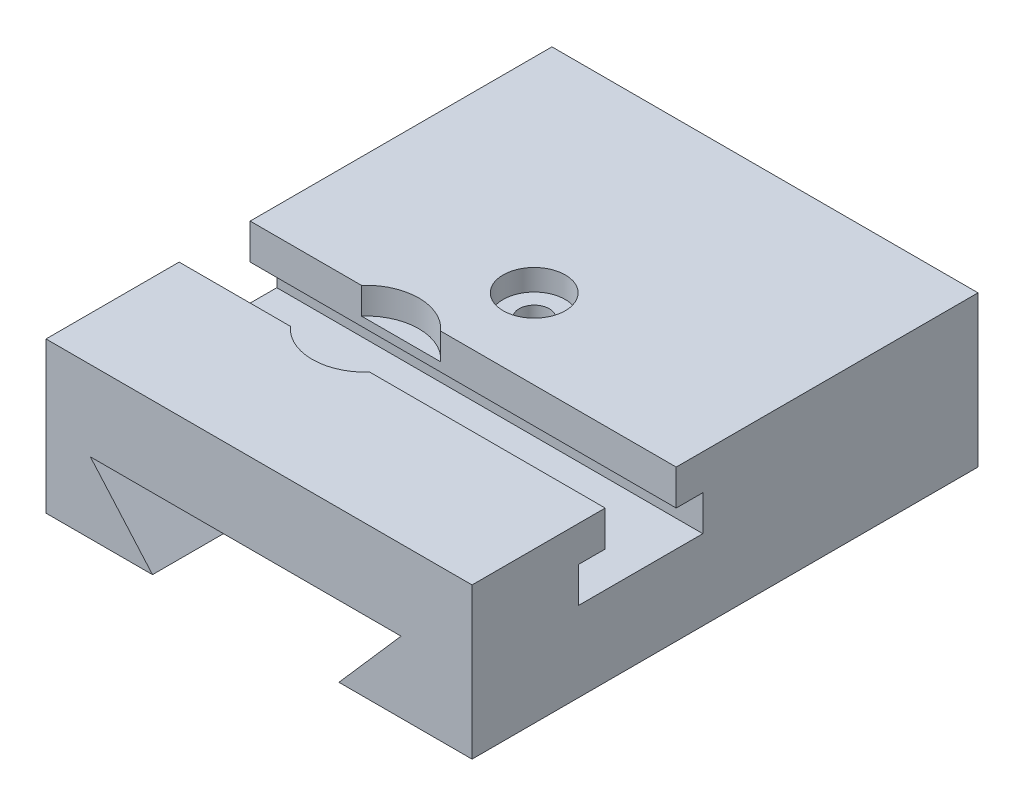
SolidWorks part; units mm, degrees
ref_plane "Piano frontale" through (0, 0, 0) normal (0, 0, 1) x (1, 0, 0)
ref_plane "Piano superiore" through (0, 0, 0) normal (0, 1, 0) x (1, 0, 0)
ref_plane "Piano destro" through (0, 0, 0) normal (1, 0, 0) x (0, 0, -1)
sketch "Schizzo1" plane through (0, 0, 0) normal (0, 1, 0) x (1, 0, 0)
  line L1 (-24, 28.5) -> (24, 28.5)
  line L2 (-24, 28.5) -> (-24, -28.5)
  line L3 (-24, -28.5) -> (24, -28.5)
  line L4 (24, 28.5) -> (24, -28.5)
  line L5 (-24, 28.5) -> (24, -28.5) construction
  line L6 (-24, -28.5) -> (24, 28.5) construction
  point P0 (0, 0)
  dimension "D1" = 48
  dimension "D2" = 57
extrude "Estrusione-Estrusione1" add sketch "Schizzo1" along normal blind 17
sketch "Schizzo2" plane through (24, 0, 0) normal (1, 0, 0) x (0, 0, -1)
  line L0 (-13.5, 17) -> (-13.5, 13)
  line L1 (-28.5, 17) -> (28.5, 17) construction
  line L2 (-13.5, 13) -> (-16.5, 13)
  line L3 (-16.5, 13) -> (-16.5, 9)
  line L4 (-16.5, 9) -> (-2.5, 9)
  line L5 (-2.5, 9) -> (-2.5, 13)
  line L6 (-2.5, 13) -> (-5.5, 13)
  line L7 (-5.5, 13) -> (-5.5, 17)
  line L8 (-5.5, 17) -> (-13.5, 17)
  dimension "D1" = 4
  dimension "D2" = 4
  dimension "D3" = 14
  dimension "D4" = 15
  dimension "D5" = 3
extrude "Taglio-Estrusione1" cut sketch "Schizzo2" against normal up to next
sketch "Schizzo4" plane through (0, 17, 0) normal (0, 1, 0) x (1, 0, 0)
  line L0 (-24, 28.5) -> (-24, -5.5) construction
  line L1 (-24, -28.5) -> (24, -28.5) construction
  circle A0 centre (-7, -9.5) radius 6
  dimension "D1" = 12
  dimension "D2" = 17
  dimension "D3" = 19
extrude "Taglio-Estrusione3" cut sketch "Schizzo4" against normal blind 3
sketch "Schizzo3" plane through (0, 0, 28.5) normal (0, 0, 1) x (1, 0, 0)
  line L0 (0, 22.4056) -> (0, -6.8626) construction
  line L1 (-7, 0) -> (-7, 3)
  line L2 (-24, 0) -> (24, 0) construction
  line L3 (-7, 3) -> (-13, 3)
  line L4 (-13, 3) -> (-13, 1.5)
  line L5 (-13, 1.5) -> (-9, 1.5)
  line L6 (-9, 1.5) -> (-9, 0)
  line L7 (-9, 0) -> (-7, 0)
  line L8 (9, 0) -> (7, 0)
  line L9 (9, 1.5) -> (9, 0)
  line L10 (13, 1.5) -> (9, 1.5)
  line L11 (13, 3) -> (13, 1.5)
  line L12 (7, 3) -> (13, 3)
  line L13 (7, 0) -> (7, 3)
  dimension "D1" = 1.5
  dimension "D2" = 1.5
  dimension "D3" = 6
  dimension "D4" = 2
  dimension "D5" = 15
extrude "Taglio-Estrusione2" [suppressed] cut sketch "Schizzo3" against normal up to next
sketch "Schizzo5" plane through (0, 0, 28.5) normal (0, 0, 1) x (1, 0, 0)
  line L0 (9, 0) -> (16, 8)
  line L1 (-24, 0) -> (24, 0) construction
  line L2 (16, 8) -> (-19, 8)
  line L3 (-19, 8) -> (-12, 0)
  line L4 (-12, 0) -> (9, 0)
  line L5 (24, 17) -> (24, 0) construction
  line L6 (-24, 17) -> (-24, 0) construction
  dimension "D1" = 35
  dimension "D2" = 15
  dimension "D3" = 8
  dimension "D4" = 12
extrude "Taglio-Estrusione4" cut sketch "Schizzo5" against normal up to next
hole_wizard "Foro lamato per Vite M3 a testa cilindrica con calotta-1" positions "Schizzo7" profile "Schizzo8" counterbore size "M3" standard "ISO"
sketch "Schizzo7" plane through (0, 17, 0) normal (0, 1, 0) x (1, 0, 0)
  line L0 (-24, 28.5) -> (-24, -5.5) construction
  line L1 (24, 28.5) -> (-24, 28.5) construction
  point P0 (-1, 3.5)
  dimension "D1" = 23
  dimension "D2" = 25
sketch "Schizzo8" plane through (-1, 17, -3.5) normal (1, 0, 0) x (0, 0, 1)
  line L0 (0, 0) -> (0, 17)
  line L1 (0, 17) -> (1.7, 17)
  line L3 (1.7, 17) -> (1.7, 2.4)
  line L4 (1.7, 2.4) -> (3.5, 2.4)
  line L5 (3.5, 2.4) -> (3.5, 0)
  line L7 (3.5, 0) -> (0, 0)
  line L11 (0, -6.35) -> (0, 107.95) construction
  dimension "Thru Hole Dia." = 3.4
  dimension "Thru Hole Depth" = 17
  dimension "C'Bore Dia." = 7
  dimension "C'Bore Depth" = 2.4
